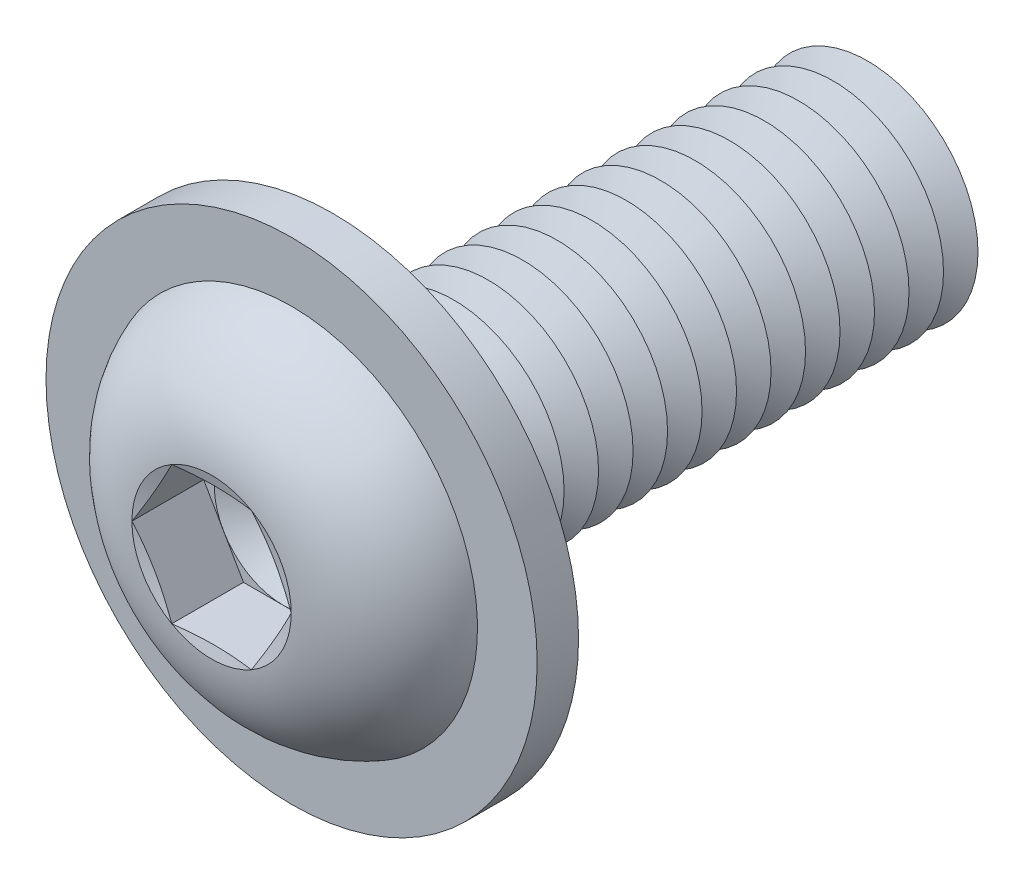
SolidWorks part; units mm, degrees
ref_plane "Front Plane" through (0, 0, 0) normal (0, 0, 1) x (1, 0, 0)
ref_plane "Top Plane" through (0, 0, 0) normal (0, 1, 0) x (1, 0, 0)
ref_plane "Right Plane" through (0, 0, 0) normal (1, 0, 0) x (0, 0, -1)
sketch "Sketch1" plane through (0, 0, 0) normal (1, 0, 0) x (0, 0, -1)
  line L0 (0, 4) -> (0, 7)
  line L3 (0, 4) -> (20, 4)
  line L4 (20, 4) -> (20, 0)
  line L5 (20, 0) -> (-4.4, 0) construction
  line L6 (-4.4, 0) -> (20, 0)
  line L7 (-4.4, 2.8867) -> (-4.4, 1.4434) construction
  line L8 (-4.4, 1.4434) -> (-4.4, 0)
  line L9 (-4.4, 2.8867) -> (-4.0132, 1.4434)
  line L10 (-4.0132, 1.4434) -> (-4.4, 1.4434)
  line L11 (20, 0) -> (22.7481, 0) construction
  line L12 (0, 7) -> (-4.4, 7) construction
  arc A1 (0, 7) -> (-4.4, 2.8867) centre (0, 2.59) ccw
  point P8 (20, 2)
  dimension "D1" = 14
  dimension "D2" = 8
  dimension "D3" = 4.4
  dimension "D4" = 5.7735
  dimension "D5" = 20
  dimension "D6" = 15
revolve "Revolve1" add sketch "Sketch1" angle 360 about L5
fillet "Fillet1" radius 0.625 1 edges at (-4, 0, 0)
sketch "Sketch2" plane through (0, 0, 0) normal (1, 0, 0) x (0, 0, -1)
  line L0 (19.375, 4) -> (20.625, 4)
  line L1 (20, 4) -> (0.625, 4) construction
  line L2 (20.625, 4) -> (20, 2.9175)
  line L3 (20, -4) -> (20, 4) construction
  line L4 (20, 2.9175) -> (19.375, 4)
  dimension "D1" = 1.25
revolve "Cut-Revolve1" cut sketch "Sketch2" angle 360 about axis through (0, 0, -20) along (0, 0, -1)
pattern_linear "LPattern1" count 16 spacing 1.25 along (0, 0, 1) of "Cut-Revolve1"
sketch "Sketch3" plane through (0, 0, 4.4) normal (0, 0, 1) x (1, 0, 0)
  line L7 (1.4434, 2.5) -> (-1.4434, 2.5)
  line L8 (-1.4434, 2.5) -> (-2.8867, 0)
  line L9 (-2.8867, 0) -> (-1.4434, -2.5)
  line L10 (-1.4434, -2.5) -> (1.4434, -2.5)
  line L11 (1.4434, -2.5) -> (2.8867, 0)
  line L12 (2.8867, 0) -> (1.4434, 2.5)
  circle A0 centre (0, 0) radius 2.5 construction
  circle A3 centre (0, 0) radius 2.8867 construction
extrude "Cut-Extrude1" cut sketch "Sketch3" against normal blind 2.6
sketch "Sketch4" plane through (0, 0, 1.8) normal (0, 0, 1) x (1, 0, 0)
  line L1 (1.4434, 2.5) -> (-1.4434, 2.5) construction
  circle A0 centre (0, 0) radius 2.5
extrude "Cut-Extrude2" cut sketch "Sketch4" against normal through all draft 60
sketch "Sketch5" plane through (0, 0, 0) normal (0, 0, -1) x (-1, 0, 0)
  circle A0 centre (0, 0) radius 8.9
  circle A1 centre (0, 0) radius 4.625
  circle A2 centre (0, 0) radius 4.625 construction
  dimension "D1" = 17.8
extrude "Boss-Extrude1" add sketch "Sketch5" against normal blind 1.5
